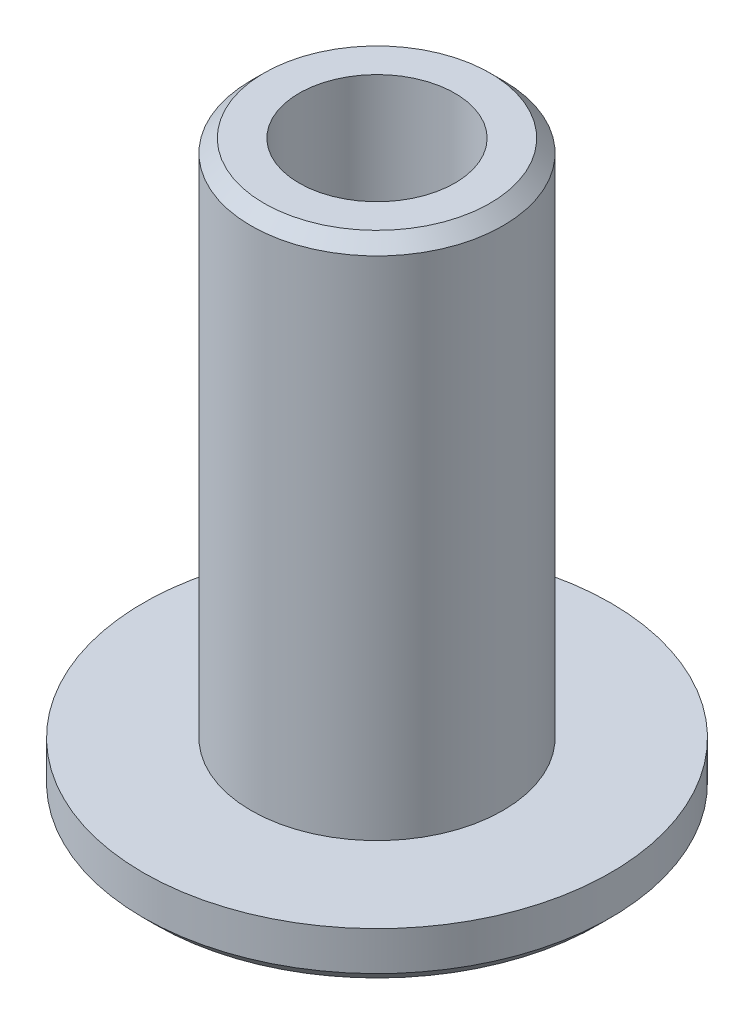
SolidWorks part; units mm, degrees
ref_plane "Ebene vorne" through (0, 0, 0) normal (0, 0, 1) x (1, 0, 0)
ref_plane "Ebene oben" through (0, 0, 0) normal (0, 1, 0) x (1, 0, 0)
ref_plane "Ebene rechts" through (0, 0, 0) normal (1, 0, 0) x (0, 0, -1)
sketch "Skizze1" plane through (0, 0, 0) normal (0, 1, 0) x (1, 0, 0)
  circle A0 centre (0, 0) radius 9
  circle A1 centre (0, 0) radius 3
  dimension "D1" = 18
  dimension "D2" = 6
extrude "Aufsatz-Linear austragen1" add sketch "Skizze1" along normal blind 2
sketch "Skizze2" plane through (0, 2, 0) normal (0, 1, 0) x (1, 0, 0)
  circle A0 centre (0, 0) radius 3 construction
  circle A1 centre (0, 0) radius 3
  circle A2 centre (0, 0) radius 4.85
  dimension "D1" = 9.7
extrude "Aufsatz-Linear austragen2" add sketch "Skizze2" along normal blind 20
chamfer "Fase1" distance 0.5 angle 45 2 edges at (0, 0, 9) (0, 22, 4.85)
